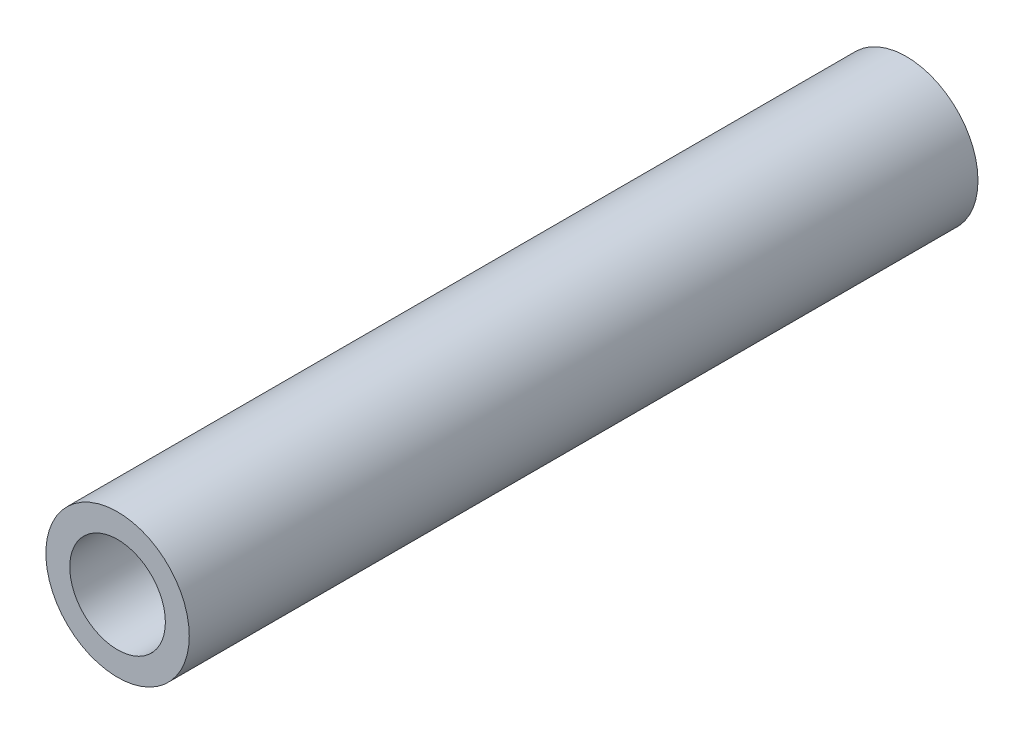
SolidWorks part; units mm, degrees
ref_plane "Plan de face" through (0, 0, 0) normal (0, 0, 1) x (1, 0, 0)
ref_plane "Plan de dessus" through (0, 0, 0) normal (0, 1, 0) x (1, 0, 0)
ref_plane "Plan de droite" through (0, 0, 0) normal (1, 0, 0) x (0, 0, -1)
sketch "Esquisse1" plane through (0, 0, 0) normal (0, 0, 1) x (1, 0, 0)
  circle A0 centre (0, 0) radius 3
  dimension "D1" = 6
extrude "Extrusion1" add sketch "Esquisse1" along normal blind 33
sketch "Esquisse2" plane through (0, 0, 33) normal (0, 0, 1) x (1, 0, 0)
  circle A0 centre (0, 0) radius 2
  dimension "D1" = 4
extrude "Enlèv. mat.-Extru.1" cut sketch "Esquisse2" against normal blind 11
sketch "Esquisse3" plane through (0, 0, 0) normal (1, 0, 0) x (0, 0, -1)
  line L0 (-24.8652, 0) -> (-16.3497, 0) construction
  line L1 (-22.1266, 0) -> (-22, -2)
  line L2 (-22, 2) -> (-22, -2) construction
  line L3 (-22, -2) -> (-21.0082, 0)
  line L4 (-22.1266, 0) -> (-21.0082, 0)
  dimension "D1" = 30
revolve "Enlèvement de matière-Révolution1" cut sketch "Esquisse3" angle 360 about L0
